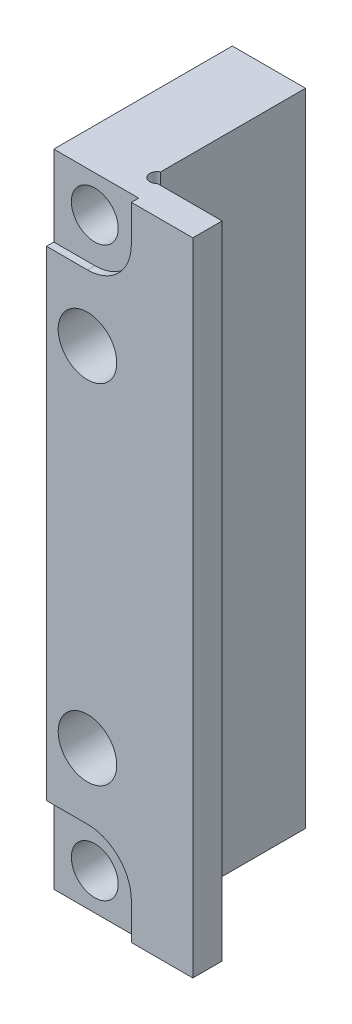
SolidWorks part; units mm, degrees
ref_plane "前基準面" through (0, 0, 0) normal (0, 0, 1) x (1, 0, 0)
ref_plane "上基準面" through (0, 0, 0) normal (0, 1, 0) x (1, 0, 0)
ref_plane "右基準面" through (0, 0, 0) normal (1, 0, 0) x (0, 0, -1)
sketch "草圖1" plane through (0, 0, 0) normal (0, 0, 1) x (1, 0, 0)
  line L0 (-29.9, 26.9) -> (-29.9, -26.9) construction
  line L1 (-38, 30) -> (38, 30) construction
  line L2 (-38, 30) -> (-38, -30) construction
  line L3 (-38, -30) -> (38, -30) construction
  line L4 (38, 30) -> (38, -30) construction
  line L5 (-38, 30) -> (38, -30) construction
  line L6 (-38, -30) -> (38, 30) construction
  line L7 (-29.9, 26.9) -> (29.9, 26.9) construction
  line L8 (-34.9, 21.9) -> (-34.9, -21.9) construction
  line L9 (-29.9, -26.9) -> (29.9, -26.9) construction
  line L10 (34.9, 21.9) -> (34.9, -21.9) construction
  line L11 (-34.9, 26.9) -> (34.9, -26.9) construction
  line L12 (-34.9, -26.9) -> (34.9, 26.9) construction
  line L13 (-34.9, 21.9) -> (-24.9, 21.9)
  line L14 (-24.9, 21.9) -> (-24.9, -21.9)
  line L15 (-24.9, -21.9) -> (-34.9, -21.9)
  line L16 (-34.9, 21.9) -> (-34.9, -21.9)
  arc A0 (29.9, -26.9) -> (34.9, -21.9) centre (29.9, -21.9) ccw construction
  arc A1 (29.9, 26.9) -> (34.9, 21.9) centre (29.9, 21.9) cw construction
  arc A2 (-34.9, -21.9) -> (-29.9, -26.9) centre (-29.9, -21.9) ccw construction
  arc A3 (-29.9, 26.9) -> (-34.9, 21.9) centre (-29.9, 21.9) ccw construction
  point P0 (0, 0)
  point P6 (0, 0)
  dimension "D5" = 5
  dimension "D1" = 76
  dimension "D2" = 60
  dimension "D3" = 3.1
  dimension "D4" = 3.1
  dimension "D6" = 5
  dimension "D7" = 10
extrude "填料-伸長1" add sketch "草圖1" against normal blind 10
sketch "草圖2" plane through (0, -21.9, 0) normal (0, -1, 0) x (1, 0, 0)
  line L0 (-24.9, -10) -> (-24.9, -2)
  line L1 (-24.9, -10) -> (-24.9, 0) construction
  line L2 (-24.9, -2) -> (-29.9, -2)
  line L3 (-29.9, -2) -> (-29.9, -10)
  line L4 (-34.9, -10) -> (-24.9, -10) construction
  line L5 (-29.9, -10) -> (-24.9, -10)
  line L6 (-27.4, -2) -> (-27.4, -10) construction
  line L7 (-29.9, -6) -> (-24.9, -6) construction
  line L8 (-27.4, -6) -> (-29.9, -2) construction
  circle A0 centre (-29.684, -2.3456) radius 0.5
  dimension "D3" = 1
  dimension "D4" = 0.3456
  dimension "D1" = 8
  dimension "D2" = 5
extrude "除料-伸長1" cut sketch "草圖2" against normal through all
sketch "草圖3" plane through (0, 0, 0) normal (0, 0, 1) x (1, 0, 0)
  line L0 (-34.9, 21.9) -> (-34.9, -21.9) construction
  line L1 (-24.9, 21.9) -> (-34.9, 21.9) construction
  line L2 (0, 0) -> (-34.9, 0) construction
  circle A0 centre (-32.1, 19.4) radius 1.6
  circle A1 centre (-32.1, -19.4) radius 1.6
  dimension "D1" = 3.2
  dimension "D2" = 2.8
  dimension "D3" = 2.5
extrude "除料-伸長2" cut sketch "草圖3" against normal through all
sketch "草圖4" plane through (0, 0, 0) normal (0, 0, 1) x (1, 0, 0)
  line L0 (-34.9, 21.9) -> (-34.9, -21.9) construction
  line L1 (-24.9, 21.9) -> (-34.9, 21.9) construction
  line L2 (-34.9, 0) -> (-24.9, 0) construction
  line L3 (-24.9, -21.9) -> (-24.9, 21.9) construction
  circle A0 centre (-32.1, 11.9) radius 2
  circle A1 centre (-32.1, -11.9) radius 2
  circle A2 centre (-32.1, 19.4) radius 1.6 construction
  dimension "D1" = 2.8
  dimension "D3" = 4
  dimension "D4" = 11.9
  dimension "D5" = 2.8
  dimension "D2" = 10
  dimension "D6" = 7.5
extrude "除料-伸長3" cut sketch "草圖4" against normal through all
sketch "草圖5" plane through (0, 0, 0) normal (0, 0, 1) x (1, 0, 0)
  line L0 (-29.1, 19.4) -> (-29.1, 21.9)
  line L1 (-24.9, 21.9) -> (-34.9, 21.9) construction
  line L2 (-29.1, 21.9) -> (-34.9, 21.9)
  line L3 (-32.1, 16.4) -> (-34.9, 16.4)
  line L4 (-34.9, 21.9) -> (-34.9, -21.9) construction
  line L5 (-34.9, 16.4) -> (-34.9, 21.9)
  line L6 (-29.1, -19.4) -> (-29.1, -21.9)
  line L9 (-32.1, -16.4) -> (-34.9, -16.4)
  line L10 (-34.9, -16.4) -> (-34.9, -21.9)
  line L13 (-29.1, -21.9) -> (-34.9, -21.9)
  circle A1 centre (-32.1, -19.4) radius 3 construction
  arc A2 (-29.1, 19.4) -> (-32.1, 16.4) centre (-32.1, 19.4) cw
  arc A3 (-32.1, -16.4) -> (-29.1, -19.4) centre (-32.1, -19.4) cw
  circle A5 centre (-32.1, 19.4) radius 3 construction
  dimension "D1" = 6
  dimension "D2" = 6
  dimension "D3" = 2.5
  dimension "D4" = 2.8
extrude "除料-伸長4" cut sketch "草圖5" against normal blind 0.5
sketch "草圖6" plane through (0, 0, -10) normal (0, 0, -1) x (-1, 0, 0)
  line L4 (29.9, 21.9) -> (29.9, -21.9)
  line L5 (29.9, -21.9) -> (34.9, -21.9)
  line L6 (34.9, -21.9) -> (34.9, 21.9)
  line L7 (34.9, 21.9) -> (29.9, 21.9)
  line L8 (29.9, 21.9) -> (29.9, -21.9)
  line L9 (29.9, -21.9) -> (34.9, -21.9)
  line L10 (34.9, -21.9) -> (34.9, 21.9)
  line L11 (34.9, 21.9) -> (29.9, 21.9)
  circle A0 centre (32.1, 19.4) radius 1.6 construction
  circle A1 centre (32.1, 19.4) radius 1.6
  circle A2 centre (32.1, 11.9) radius 2 construction
  circle A3 centre (32.1, 11.9) radius 2
  circle A4 centre (32.1, -11.9) radius 2 construction
  circle A5 centre (32.1, -11.9) radius 2
  circle A6 centre (32.1, -19.4) radius 1.6 construction
  circle A7 centre (32.1, -19.4) radius 1.6
  dimension "D1" = 0
extrude "填料-伸長2" add sketch "草圖6" along normal blind 2.7
